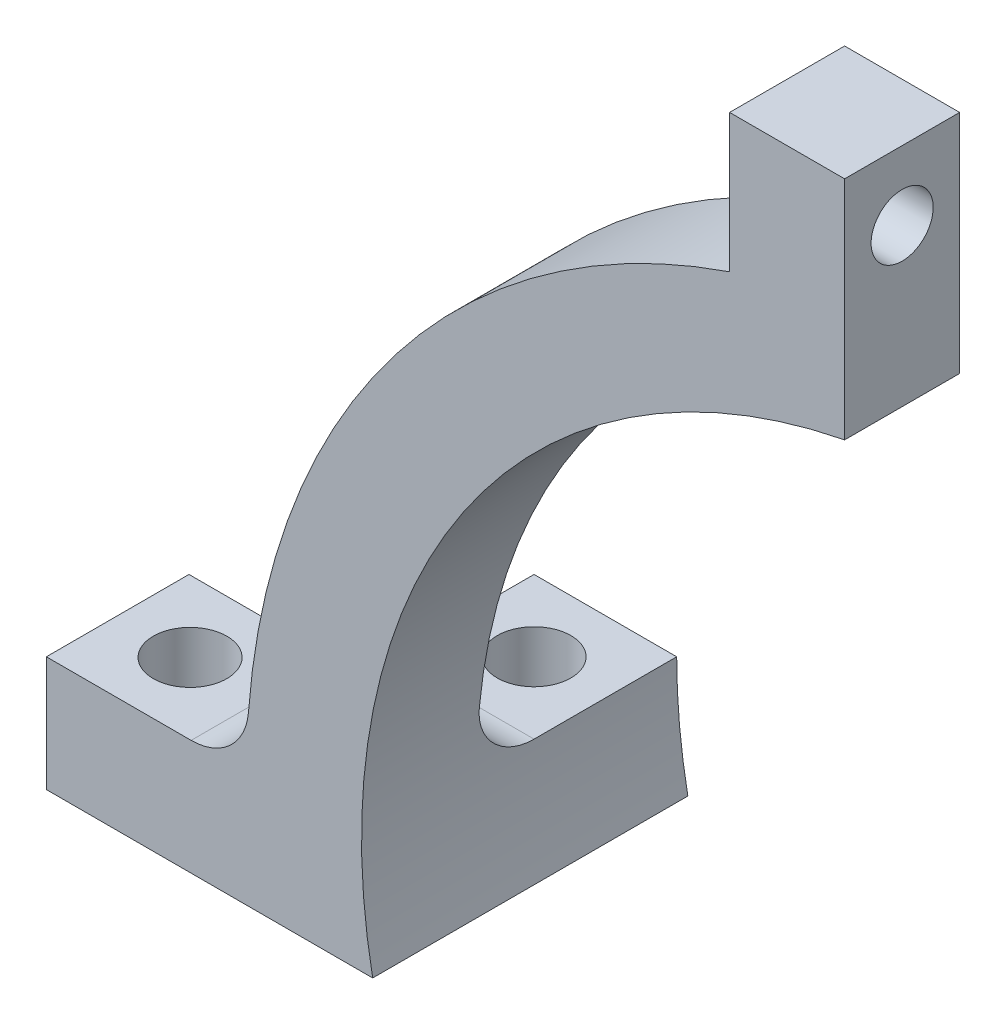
SolidWorks part; units mm, degrees
ref_plane "Plano frontal" through (0, 0, 0) normal (0, 0, 1) x (1, 0, 0)
ref_plane "Plano superior" through (0, 0, 0) normal (0, 1, 0) x (1, 0, 0)
ref_plane "Plano direito" through (0, 0, 0) normal (1, 0, 0) x (0, 0, -1)
sketch "Esboço1" plane through (0, 0, 0) normal (0, 0, 1) x (1, 0, 0)
  line L5 (5.4853, 0) -> (0, 0)
  line L6 (31, 33.3554) -> (31, 28.3554) construction
  line L7 (26, 40.3428) -> (26, 30.5147)
  line L9 (26, 40.3428) -> (21, 40.3428)
  line L10 (21, 40.3428) -> (21, 34.3428)
  line L11 (0, 5) -> (0, 0)
  arc A2 (0, 5) -> (21, 34.3428) centre (31, 5) cw
  arc A3 (26, 30.5147) -> (5.4853, 0) centre (31, 5) ccw
  point P1 (0, 0)
  point P3 (0, 0)
  point P4 (1.591, 4.0493)
  point P7 (1.8686, 9.3308)
  point P13 (0, 5.2904)
  point P15 (0, 7.0885)
  point P17 (5, 5)
  point P18 (5, 5)
  point P19 (2.7538, 0.8267)
  point P20 (5, 5)
  point P22 (5.8235, 0)
  point P23 (5.5857, 0)
  dimension "D1" = 5
  dimension "D2" = 5
  dimension "D4" = 26
  dimension "D6" = 5
  dimension "D7" = 6
  dimension "D8" = 5
extrude "Ressalto-extrusão1" add sketch "Esboço1" along normal blind 5
sketch "Esboço5" plane through (0, 0, 0) normal (-1, 0, 0) x (0, 0, 1)
  line L0 (5, 5) -> (0, 5) construction
  line L1 (-1.2, 0) -> (5, 0)
  line L2 (-1.2, 0) -> (-1.2, 5)
  line L3 (-1.2, 5) -> (5, 5)
  line L4 (5, 0) -> (5, 5)
  line L5 (5, 5) -> (5, 0) construction
  point P7 (0, 0)
  dimension "D1" = 6.2
extrude "Ressalto-extrusão3" add sketch "Esboço5" along normal blind 8.7
sketch "Esboço4" plane through (0, 0, 0) normal (0, 0, 1) x (1, 0, 0)
  line L1 (-8.7, 0) -> (5.4853, 0) construction
  line L2 (-1.2, 0) -> (5.4853, 0)
  line L4 (5, 5) -> (-1.2, 5)
  line L5 (-1.2, 5) -> (-1.2, 0)
  arc A0 (26, 30.5147) -> (5.4853, 0) centre (31, 5) ccw construction
  arc A1 (5, 5) -> (5.4853, 0) centre (31, 5) ccw
  point P8 (0, 0)
  point P11 (0, 0)
  point P12 (0, 0)
  point P13 (0, 0)
  point P14 (5.4853, 0)
  dimension "D1" = 6.2
  dimension "D2" = 5
extrude "Ressalto-extrusão2" add sketch "Esboço4" against normal blind 8.7
fillet "Filete1" radius 2.5 2 edges at (0, 5, 2.5) (2.5, 5, 0)
sketch "Esboço2" plane through (21, 0, 0) normal (-1, 0, 0) x (0, 0, 1)
  line L0 (0, 40.3428) -> (5, 34.3428) construction
  circle A0 centre (2.5, 37.3428) radius 1.35
  dimension "D1" = 2.7
extrude "Corte-extrusão1" cut sketch "Esboço2" against normal up to next
sketch "Esboço3" plane through (0, 5, 0) normal (0, 1, 0) x (1, 0, 0)
  line L0 (-2.4066, -5) -> (-8.7, 1.2) construction
  line L1 (-1.2, 2.5) -> (5, 8.7) construction
  line L2 (-8.7, -5) -> (-8.7, 1.2) construction
  line L3 (-1.2, 8.7) -> (-1.2, 2.5) construction
  line L4 (-8.7, -5) -> (-2.4066, -5) construction
  line L5 (-2.4066, -5) -> (-2.4066, 1.2) construction
  line L6 (-8.7, -5) -> (-2.4066, -5) construction
  line L7 (-8.7, 1.2) -> (-2.4066, 1.2) construction
  circle A0 centre (-5.5533, -1.9) radius 1.6
  circle A1 centre (1.9, 5.6) radius 1.6
  point P12 (1.9, 5.6)
  point P13 (0, 0)
  point P14 (-2.4066, -6.2)
  point P16 (0, 0)
  point P17 (-6.2, 0)
  point P20 (-4.3033, -3.5793)
  point P21 (-6.2, 0)
  point P23 (0, 0)
  point P24 (0, 0)
  point P25 (-1.2, 3.1524)
  point P28 (-5.276, -5)
  point P31 (-1.2, 2.5)
  point P33 (-2.4066, -5)
  point P38 (0, 0)
  point P39 (-8.7, 1.2)
  point P42 (0, 0)
  dimension "D1" = 3.2
extrude "Corte-extrusão2" cut sketch "Esboço3" against normal up to next
fillet "Filete2" radius 1.25 1 edges at (-1.2, 2.6552, -1.2)
